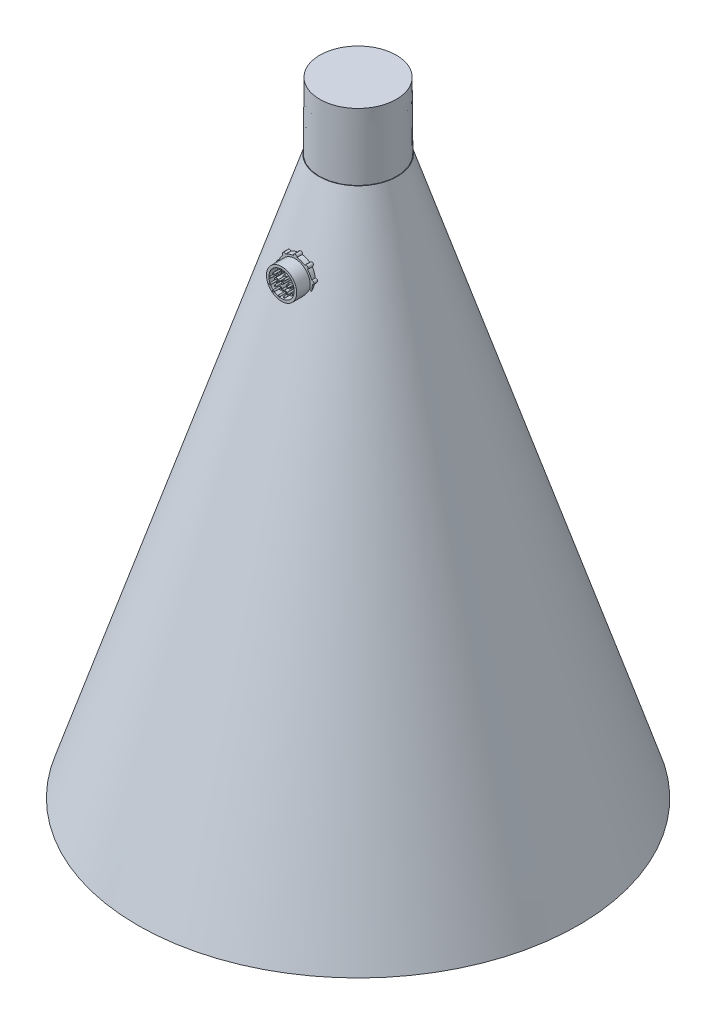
SolidWorks part; units mm, degrees
ref_plane "Front Plane" through (0, 0, 0) normal (0, 0, 1) x (1, 0, 0)
ref_plane "Top Plane" through (0, 0, 0) normal (0, 1, 0) x (1, 0, 0)
ref_plane "Right Plane" through (0, 0, 0) normal (1, 0, 0) x (0, 0, -1)
imported_body "Imported1"
imported_body "Imported2"
imported_body "Imported3"
imported_body "Imported4"
ref_plane "Plane1" through (0, 38.1, 0) normal (0, 1, 0) x (1, 0, 0)
sketch "Sketch1" plane through (0, 0, 0) normal (1, 0, 0) x (0, 0, -1)
  line L0 (0, 38.1) -> (207.2845, -531.4094)
  line L1 (0, 0) -> (0, 138.2599) construction
  line L2 (281.7449, 38.1) -> (-281.7449, 38.1) construction
  line L3 (0, 38.1) -> (0, -531.4094)
  line L4 (0, -531.4094) -> (207.2845, -531.4094)
  dimension "D1" = 20
revolve "Revolve1" [suppressed] add sketch "Sketch1" angle 360 about L1
sketch "Sketch2" plane through (0, 38.1, 0) normal (0, 1, 0) x (1, 0, 0)
  circle A2 centre (0, 0) radius 37.4396
  circle A3 centre (0, 0) radius 37.4396
  dimension "D1" = 0
extrude "Boss-Extrude1" add sketch "Sketch2" against normal blind 533.4 draft 18 separate body
equation "\"Buoyancy\"= \"SW-Volume\" * ( \"SW-Density\" - .037062 )"
